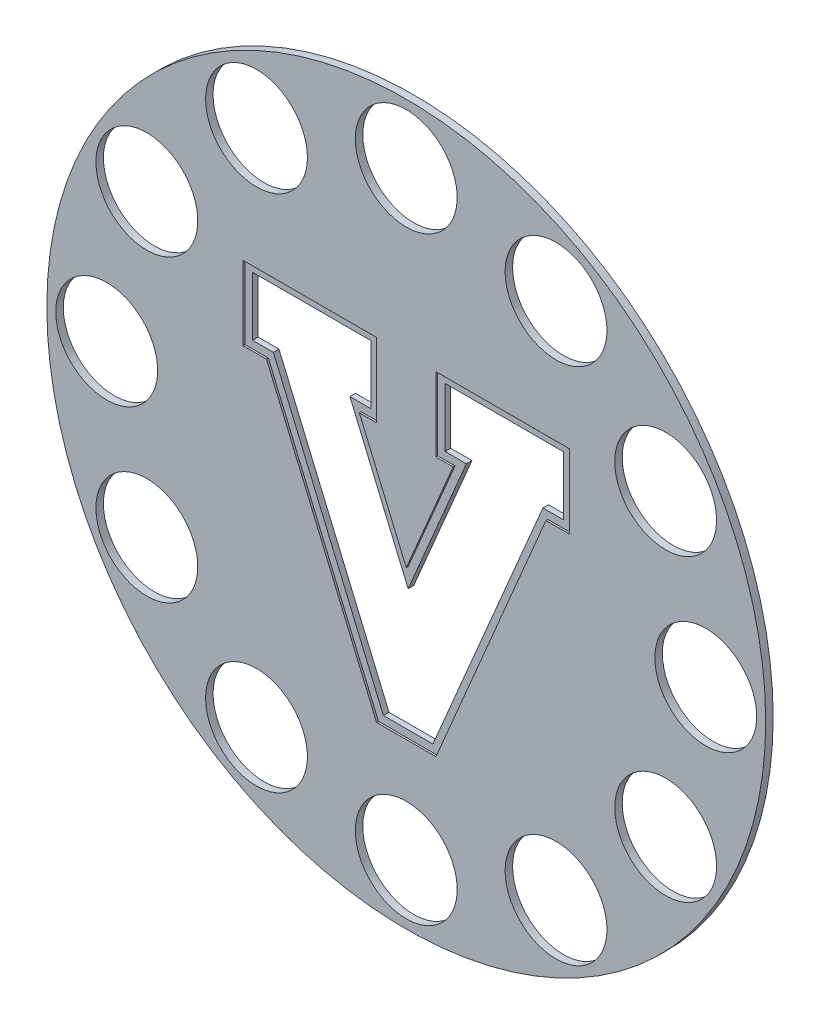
SolidWorks part; units mm, degrees
ref_plane "Front Plane" through (0, 0, 0) normal (0, 0, 1) x (1, 0, 0)
ref_plane "Top Plane" through (0, 0, 0) normal (0, 1, 0) x (1, 0, 0)
ref_plane "Right Plane" through (0, 0, 0) normal (1, 0, 0) x (0, 0, -1)
sketch "Sketch1" plane through (0, 0, 0) normal (0, 0, 1) x (1, 0, 0)
  line L0 (0, 508) -> (0, 0) construction
  line L1 (-9.0217, 784.0457) -> (1590.9783, 784.0457) construction
  line L2 (-263.8171, 221.7679) -> (-62.7583, 221.7679)
  line L3 (-62.7583, 221.7679) -> (-62.7583, 121.8195)
  line L4 (-62.7583, 121.8195) -> (-98.7862, 121.8195)
  line L5 (-98.7862, 121.8195) -> (0, -111.1996)
  line L7 (41.9693, -318.2865) -> (-41.9693, -318.2865)
  line L8 (-41.9693, -318.2865) -> (-228.5479, 121.8195)
  line L9 (-228.5479, 121.8195) -> (-263.8171, 121.8195)
  line L10 (-263.8171, 121.8195) -> (-263.8171, 221.7679)
  line L11 (228.5479, 121.8195) -> (263.8171, 121.8195)
  line L12 (41.9693, -318.2865) -> (228.5479, 121.8195)
  line L13 (98.7862, 121.8195) -> (0, -111.1996)
  line L14 (62.7583, 121.8195) -> (98.7862, 121.8195)
  line L15 (62.7583, 221.7679) -> (62.7583, 121.8195)
  line L16 (263.8171, 221.7679) -> (62.7583, 221.7679)
  line L17 (263.8171, 121.8195) -> (263.8171, 221.7679)
  circle A0 centre (0, 0) radius 609.6
  circle A2 centre (0, 508) radius 86.36
  circle A3 centre (254, 439.9409) radius 86.36
  circle A4 centre (439.9409, 254) radius 86.36
  circle A5 centre (508, 0) radius 86.36
  circle A6 centre (439.9409, -254) radius 86.36
  circle A7 centre (254, -439.9409) radius 86.36
  circle A8 centre (0, -508) radius 86.36
  circle A9 centre (-254, -439.9409) radius 86.36
  circle A10 centre (-439.9409, -254) radius 86.36
  circle A11 centre (-508, 0) radius 86.36
  circle A12 centre (-439.9409, 254) radius 86.36
  circle A13 centre (-254, 439.9409) radius 86.36
  point P29 (0, 0)
  dimension "D1" = 1219.2
  dimension "D2" = 172.72
  dimension "D3" = 508
  dimension "D4" = 12
extrude "Boss-Extrude1" add sketch "Sketch1" along normal blind 12.7
sketch "Sketch2" plane through (0, 0, 12.7) normal (0, 0, 1) x (1, 0, 0)
  line L126 (11.6927, -106.2426) -> (-79.608, 109.1195)
  line L127 (-236.958, 109.1195) -> (-53.6619, -323.2435)
  line L128 (-276.5171, 109.1195) -> (-236.958, 109.1195)
  line L129 (-79.608, 109.1195) -> (-50.0583, 109.1195)
  line L130 (-50.0583, 109.1195) -> (-50.0583, 234.4679)
  line L131 (-276.5171, 234.4679) -> (-276.5171, 109.1195)
  line L132 (-50.0583, 234.4679) -> (-276.5171, 234.4679)
  line L133 (0, -78.6617) -> (-79.608, 109.1195)
  line L135 (-276.5171, 109.1195) -> (-236.958, 109.1195)
  line L136 (-79.608, 109.1195) -> (-50.0583, 109.1195)
  line L137 (-50.0583, 109.1195) -> (-50.0583, 234.4679)
  line L138 (-276.5171, 234.4679) -> (-276.5171, 109.1195)
  line L139 (-50.0583, 234.4679) -> (-276.5171, 234.4679)
  line L198 (0, -78.6617) -> (-87.0935, 126.7765)
  line L199 (-240.2406, 116.8625) -> (-50.3794, -330.9865)
  line L200 (-50.3794, -330.9865) -> (50.3794, -330.9865)
  line L201 (50.3794, -330.9865) -> (236.958, 109.1195)
  line L202 (236.958, 109.1195) -> (276.5171, 109.1195)
  line L203 (276.5171, 109.1195) -> (276.5171, 234.4679)
  line L204 (276.5171, 234.4679) -> (50.0583, 234.4679)
  line L205 (50.0583, 234.4679) -> (50.0583, 109.1195)
  line L206 (50.0583, 109.1195) -> (79.608, 109.1195)
  line L207 (79.608, 109.1195) -> (0, -78.6617)
  line L208 (0, -78.6617) -> (-79.608, 109.1195)
  line L209 (-236.958, 109.1195) -> (-50.3794, -330.9865)
  line L210 (-50.3794, -330.9865) -> (50.3794, -330.9865)
  line L211 (50.3794, -330.9865) -> (236.958, 109.1195)
  line L212 (236.958, 109.1195) -> (276.5171, 109.1195)
  line L213 (276.5171, 109.1195) -> (276.5171, 234.4679)
  line L214 (276.5171, 234.4679) -> (50.0583, 234.4679)
  line L215 (50.0583, 234.4679) -> (50.0583, 109.1195)
  line L216 (50.0583, 109.1195) -> (79.608, 109.1195)
  line L217 (79.608, 109.1195) -> (0, -78.6617)
  dimension "D1" = 12.7
  dimension "D2" = 12.7
extrude "Cut-Extrude1" cut sketch "Sketch2" against normal blind 3.175 and the other way through all contours L216 L217 L133 L136 L137 L139 L138 L135 L209 L210 L211 L212 L213 L214 L215 M28 M14 M15 M16 M17 M18 M19 M20 M21 M22 M23 M24 M25 M26 M27
sketch "Sketch3" plane through (0, 0, 12.7) normal (0, 0, 1) x (1, 0, 0)
  line B0 (50.0583, 109.1195) -> (79.608, 109.1195)
  line B1 (79.608, 109.1195) -> (0, -78.6617)
  line B2 (0, -78.6617) -> (-79.608, 109.1195)
  line B3 (-79.608, 109.1195) -> (-50.0583, 109.1195)
  line B4 (-50.0583, 109.1195) -> (-50.0583, 234.4679)
  line B5 (-50.0583, 234.4679) -> (-276.5171, 234.4679)
  line B6 (-276.5171, 234.4679) -> (-276.5171, 109.1195)
  line B7 (-276.5171, 109.1195) -> (-236.958, 109.1195)
  line B8 (-236.958, 109.1195) -> (-50.3794, -330.9865)
  line B9 (-50.3794, -330.9865) -> (50.3794, -330.9865)
  line B10 (50.3794, -330.9865) -> (236.958, 109.1195)
  line B11 (236.958, 109.1195) -> (276.5171, 109.1195)
  line B12 (276.5171, 109.1195) -> (276.5171, 234.4679)
  line B13 (276.5171, 234.4679) -> (50.0583, 234.4679)
  line B14 (50.0583, 234.4679) -> (50.0583, 109.1195)
  line B15 (41.9693, -318.2865) -> (-41.9693, -318.2865)
  line B16 (228.5479, 121.8195) -> (41.9693, -318.2865)
  line B17 (263.8171, 121.8195) -> (228.5479, 121.8195)
  line B18 (263.8171, 221.7679) -> (263.8171, 121.8195)
  line B19 (62.7583, 221.7679) -> (263.8171, 221.7679)
  line B20 (62.7583, 121.8195) -> (62.7583, 221.7679)
  line B21 (98.7862, 121.8195) -> (62.7583, 121.8195)
  line B22 (0, -111.1996) -> (98.7862, 121.8195)
  line B23 (-98.7862, 121.8195) -> (0, -111.1996)
  line B24 (-62.7583, 121.8195) -> (-98.7862, 121.8195)
  line B25 (-62.7583, 221.7679) -> (-62.7583, 121.8195)
  line B26 (-263.8171, 221.7679) -> (-62.7583, 221.7679)
  line B27 (-263.8171, 121.8195) -> (-263.8171, 221.7679)
  line B28 (-228.5479, 121.8195) -> (-263.8171, 121.8195)
  line B29 (-41.9693, -318.2865) -> (-228.5479, 121.8195)
sketch_block_instance "Block1-1"
sketch_block "Block1"
